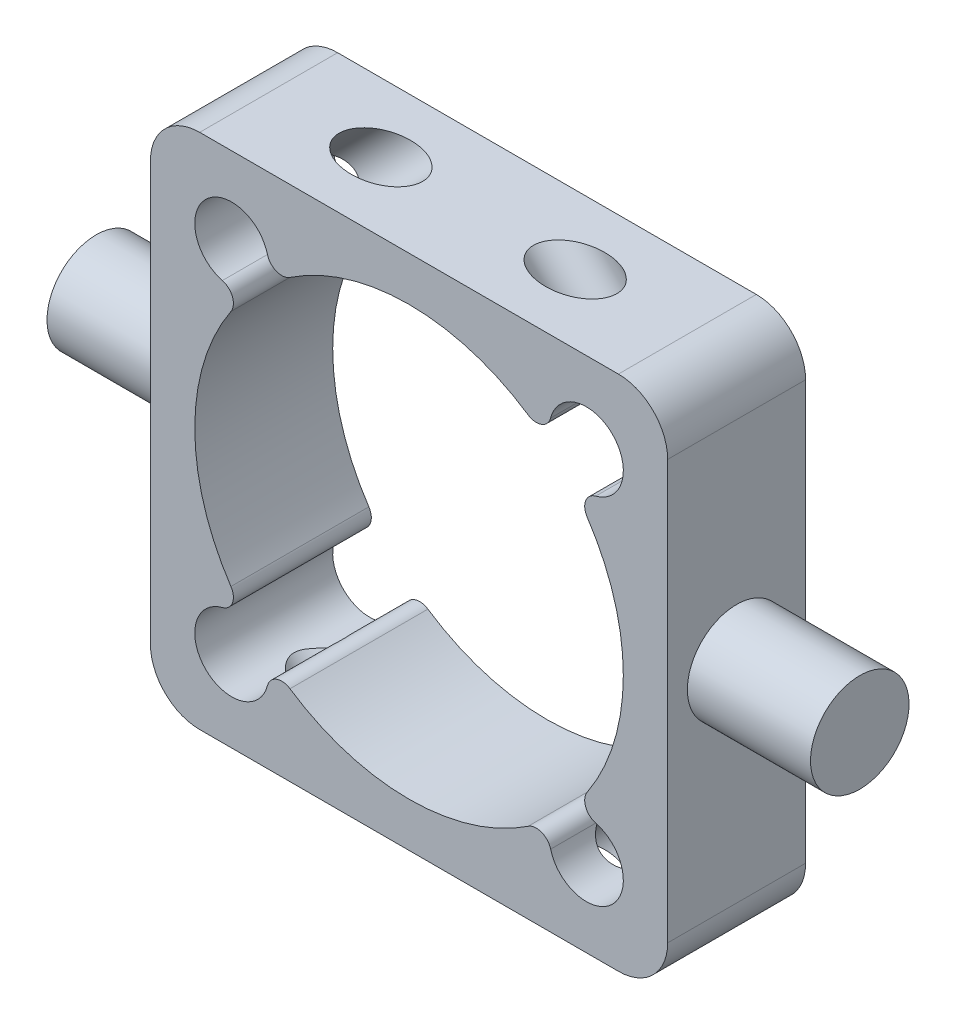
SolidWorks part; units mm, degrees
ref_plane "Plano frontal" through (0, 0, 0) normal (0, 0, 1) x (1, 0, 0)
ref_plane "Plano superior" through (0, 0, 0) normal (0, 1, 0) x (1, 0, 0)
ref_plane "Plano direito" through (0, 0, 0) normal (1, 0, 0) x (0, 0, -1)
sketch "Esboço1" plane through (0, 0, 0) normal (0, 0, 1) x (1, 0, 0)
  line L0 (0, 24.4094) -> (0, -31.769) construction
  line L1 (-52.5, 52.5) -> (52.5, 52.5)
  line L2 (-52.5, 52.5) -> (-52.5, -52.5)
  line L3 (-52.5, -52.5) -> (52.5, -52.5)
  line L4 (52.5, 52.5) -> (52.5, -52.5)
  line L5 (-35.6169, 0) -> (36.185, 0) construction
  arc A0 (-36.1639, 24.1748) -> (-36.1639, -24.1748) centre (0, 0) ccw
  arc A1 (-28.7443, 37.8986) -> (-37.8986, 28.7443) centre (-36, 36) ccw
  arc A2 (37.8986, 28.7443) -> (28.7443, 37.8986) centre (36, 36) ccw
  arc A3 (28.7443, -37.8986) -> (37.8986, -28.7443) centre (36, -36) ccw
  arc A4 (-37.8986, -28.7443) -> (-28.7443, -37.8986) centre (-36, -36) ccw
  arc A5 (24.1748, 36.1639) -> (-24.1748, 36.1639) centre (0, 0) ccw
  arc A6 (36.1639, -24.1748) -> (36.1639, 24.1748) centre (0, 0) ccw
  arc A7 (-24.1748, -36.1639) -> (24.1748, -36.1639) centre (0, 0) ccw
  arc A8 (-28.7443, 37.8986) -> (-24.1748, 36.1639) centre (-25.842, 38.658) ccw
  arc A9 (-36.1639, 24.1748) -> (-37.8986, 28.7443) centre (-38.658, 25.842) ccw
  arc A10 (-24.1748, -36.1639) -> (-28.7443, -37.8986) centre (-25.842, -38.658) ccw
  arc A11 (-37.8986, -28.7443) -> (-36.1639, -24.1748) centre (-38.658, -25.842) ccw
  arc A12 (24.1748, -36.1639) -> (28.7443, -37.8986) centre (25.842, -38.658) cw
  arc A13 (36.1639, -24.1748) -> (37.8986, -28.7443) centre (38.658, -25.842) ccw
  arc A14 (36.1639, 24.1748) -> (37.8986, 28.7443) centre (38.658, 25.842) cw
  arc A15 (24.1748, 36.1639) -> (28.7443, 37.8986) centre (25.842, 38.658) ccw
  point P28 (-30, -31.5)
  point P35 (31.5, -30)
  point P40 (30, 31.5)
  dimension "D2" = 87
  dimension "D4" = 15
  dimension "D6" = 3
  dimension "D1" = 105
  dimension "D3" = 72
  dimension "D5" = 72
extrude "Extrusão1" add sketch "Esboço1" along normal blind 28
sketch "Esboço2" plane through (-52.5, 0, 0) normal (-1, 0, 0) x (0, 0, 1)
  line L0 (14, 52.5) -> (14, -52.5) construction
  line L1 (28, 52.5) -> (0, 52.5) construction
  line L2 (28, -52.5) -> (0, -52.5) construction
  line L3 (0, 0) -> (28, 0) construction
  line L4 (0, 52.5) -> (0, -52.5) construction
  line L5 (28, 52.5) -> (28, -52.5) construction
  circle A0 centre (14, 0) radius 10
  dimension "D1" = 20
extrude "Extrusão2" add sketch "Esboço2" along normal blind 25
mirror "Espelhar1" about plane through (0, 0, 0) normal (1, 0, 0) of "Extrusão2"
fillet "Filete2" radius 10 4 edges at (-52.5, 52.5, 14) (52.5, 52.5, 14) (52.5, -52.5, 14) (-52.5, -52.5, 14)
ref_plane "Plano1" through (0, 0, 0) normal (1, 0, 0) x (0, 0, -1)
ref_plane "Plano2" through (4.5771, -4.5771, 0) normal (0.7071, -0.7071, 0) x (0.7071, 0.7071, 0)
ref_plane "Plano3" through (-27.2427, 27.2427, 0) normal (0.7071, -0.7071, 0) x (0.7071, 0.7071, 0)
sketch "Esboço6" plane through (-27.2427, 27.2427, 0) normal (0.7071, -0.7071, 0) x (0.7071, 0.7071, 0)
  line L0 (31.9952, 14) -> (-1.9393, 14) construction
  line L1 (67.1751, 0) -> (7.0711, 0) construction
  line L2 (67.1751, 28) -> (7.0711, 28) construction
  line L3 (7.0711, 0) -> (7.0711, 28) construction
  circle A0 centre (51.0711, 14) radius 6
  dimension "D1" = 12
  dimension "D2" = 44
extrude "Extrusão5" cut sketch "Esboço6" along normal blind 37
mirror "Espelhar2" about plane through (0, 0, 0) normal (1, 0, 0) of "Extrusão5"
mirror "Espelhar3" about plane through (0, 0, 0) normal (0, 1, 0) of "Espelhar2", "Extrusão5"
